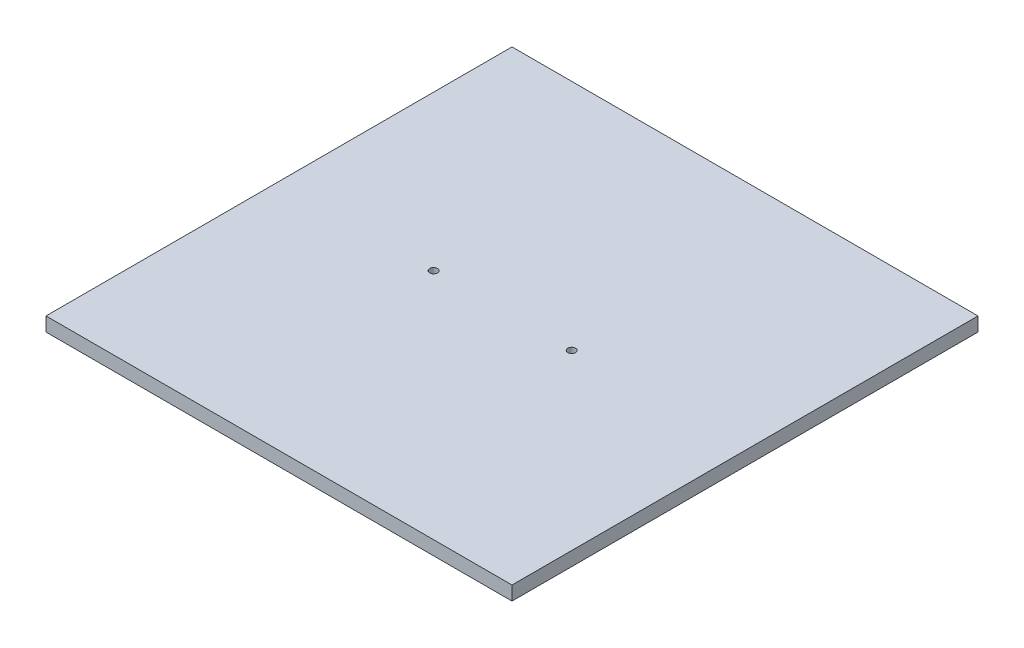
SolidWorks part; units mm, degrees
ref_plane "Front Plane" through (0, 0, 0) normal (0, 0, 1) x (1, 0, 0)
ref_plane "Top Plane" through (0, 0, 0) normal (0, 1, 0) x (1, 0, 0)
ref_plane "Right Plane" through (0, 0, 0) normal (1, 0, 0) x (0, 0, -1)
sketch "Sketch1" plane through (0, 0, 0) normal (0, 1, 0) x (1, 0, 0)
  line L0 (150, 300) -> (150, 0) construction
  line L1 (0, 0) -> (300, 0)
  line L2 (0, 0) -> (0, 300)
  line L3 (0, 300) -> (300, 300)
  line L4 (300, 0) -> (300, 300)
  circle A0 centre (99.56, 150) radius 2.5
  circle A1 centre (188.44, 150) radius 2.5
extrude "Boss-Extrude1" add sketch "Sketch1" along normal blind 9
equation "\"D6@Sketch1\"=(\"D3@Sketch1\"/2)+6"
